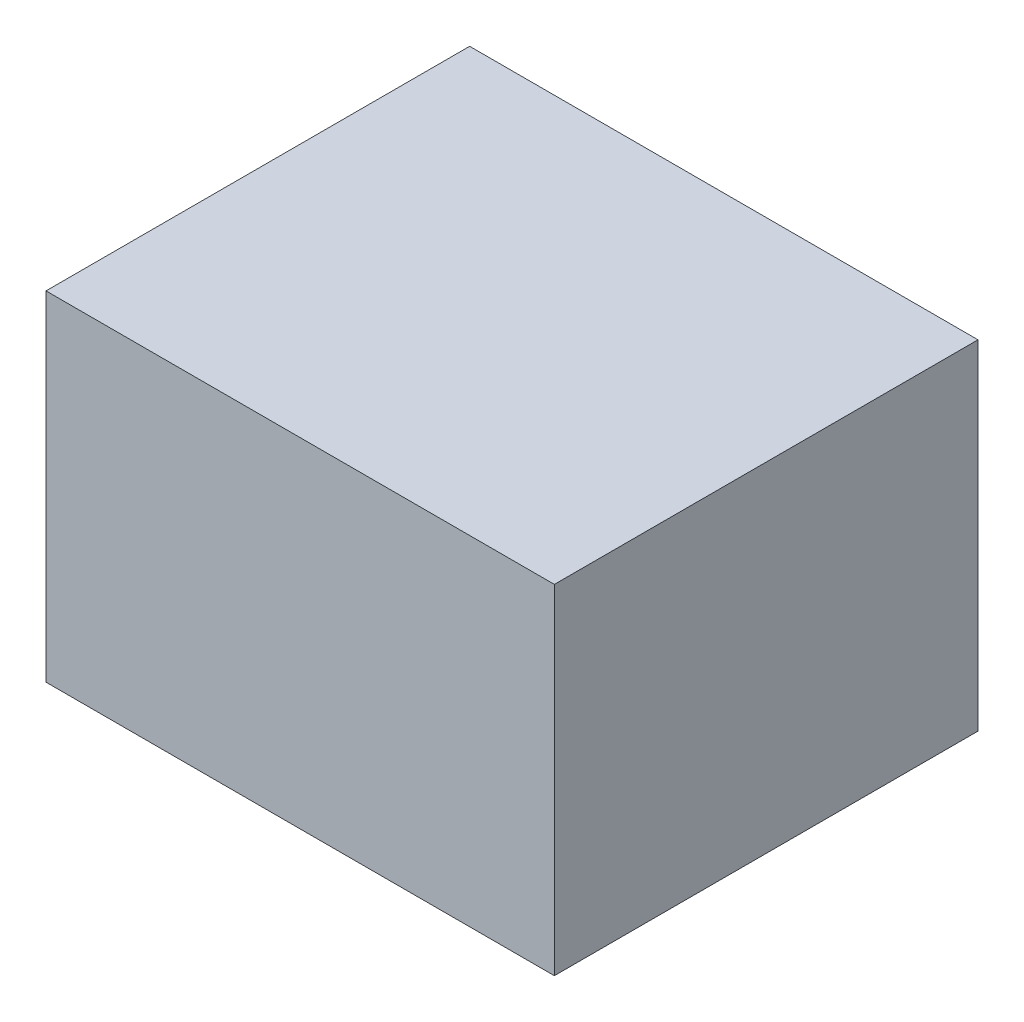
SolidWorks part; units mm, degrees
ref_plane "Plan de face" through (0, 0, 0) normal (0, 0, 1) x (1, 0, 0)
ref_plane "Plan de dessus" through (0, 0, 0) normal (0, 1, 0) x (1, 0, 0)
ref_plane "Plan de droite" through (0, 0, 0) normal (1, 0, 0) x (0, 0, -1)
sketch "Esquisse1" plane through (0, 0, 0) normal (0, 0, 1) x (1, 0, 0)
  line L1 (0, 0) -> (60, 0)
  line L2 (0, 0) -> (0, 40)
  line L3 (0, 40) -> (60, 40)
  line L4 (60, 0) -> (60, 40)
  dimension "D1" = 40
  dimension "D2" = 60
extrude "Boss.-Extru.1" add sketch "Esquisse1" along normal mid plane 50
sketch "Esquisse2" plane through (0, 0, 0) normal (0, -1, 0) x (1, 0, 0)
  line L0 (0, 0) -> (55, 0) construction
  line L1 (0, 25) -> (0, -25) construction
  circle A0 centre (6, 18) radius 2.5
  circle A1 centre (6, -18) radius 2.5
  circle A2 centre (55, 0) radius 2.5
  point P7 (0, 0)
  dimension "D1" = 5
  dimension "D2" = 18
  dimension "D3" = 36
  dimension "D4" = 6
  dimension "D5" = 55
